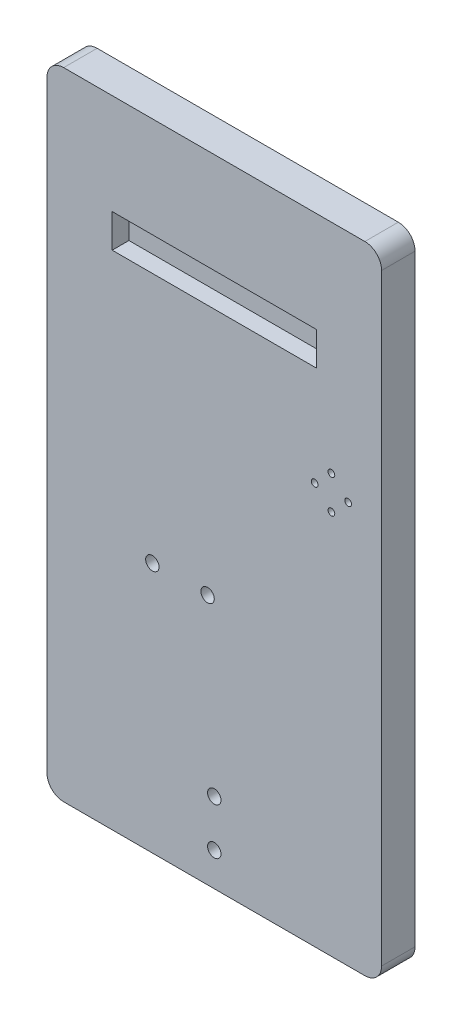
SolidWorks part; units mm, degrees
ref_plane "Face" through (0, 0, 0) normal (0, 0, 1) x (1, 0, 0)
ref_plane "Dessus" through (0, 0, 0) normal (0, 1, 0) x (1, 0, 0)
ref_plane "Droite" through (0, 0, 0) normal (1, 0, 0) x (0, 0, -1)
sketch "Esquisse1" plane through (0, 0, 0) normal (0, 0, 1) x (1, 0, 0)
  line L1 (-100, 190) -> (0, 190)
  line L2 (-100, 190) -> (-100, 0)
  line L3 (-100, 0) -> (0, 0)
  line L4 (0, 190) -> (0, 0)
  dimension "D1" = 100
  dimension "D2" = 190
extrude "Extrusion1" add sketch "Esquisse1" along normal blind 10
fillet "Congé1" radius 5 4 edges at (-100, 190, 5) (0, 190, 5) (0, 0, 5) (-100, 0, 5)
sketch "Esquisse13" plane through (0, 0, 10) normal (0, 0, 1) x (1, 0, 0)
  line L1 (-80.5, 160) -> (-19.5, 160)
  line L2 (-80.5, 160) -> (-80.5, 150)
  line L3 (-80.5, 150) -> (-19.5, 150)
  line L4 (-19.5, 160) -> (-19.5, 150)
  line L6 (-5, 190) -> (-95, 190) construction
  line L7 (-100, 185) -> (-100, 5) construction
  line L8 (0, 5) -> (0, 185) construction
  dimension "D1" = 30
  dimension "D2" = 10
  dimension "D3" = 19.5
  dimension "D4" = 19.5
extrude "Enlèv. mat.-Extru.8" cut sketch "Esquisse13" against normal blind 5
sketch "Esquisse14" plane through (0, 0, 10) normal (0, 0, 1) x (1, 0, 0)
  line L0 (-68.5, 10) -> (-68.5, 93.2446) construction
  line L1 (-95, 0) -> (-5, 0) construction
  line L3 (-100, 185) -> (-100, 5) construction
  circle A0 centre (-68.5, 75) radius 2
  circle A1 centre (-52, 75) radius 2
  dimension "D1" = 4
  dimension "D2" = 4
  dimension "D3" = 75
  dimension "D4" = 16.5
  dimension "D5" = 31.5
extrude "Enlèv. mat.-Extru.9" cut sketch "Esquisse14" against normal blind 10
sketch "Esquisse15" plane through (0, 0, 10) normal (0, 0, 1) x (1, 0, 0)
  line L0 (-5, 190) -> (-95, 190) construction
  line L1 (0, 5) -> (0, 185) construction
  line L2 (-20, 120) -> (-10, 120) construction
  line L3 (-15, 120) -> (-15, 125) construction
  line L4 (-15, 120) -> (-15, 115) construction
  circle A0 centre (-10, 120) radius 1.005
  circle A1 centre (-20, 120) radius 1.005
  circle A2 centre (-15, 125) radius 1.005
  circle A3 centre (-15, 115) radius 1.005
  dimension "D1" = 70
  dimension "D2" = 70
  dimension "D3" = 2.01
  dimension "D4" = 2.01
  dimension "D5" = 10
  dimension "D6" = 10
  dimension "D9" = 2.01
  dimension "D10" = 2.01
  dimension "D7" = 5
  dimension "D8" = 5
extrude "Enlèv. mat.-Extru.10" cut sketch "Esquisse15" against normal blind 10
sketch "Esquisse16" plane through (0, 0, 10) normal (0, 0, 1) x (1, 0, 0)
  line L0 (-50, 0) -> (-50, 67.5588) construction
  line L1 (-95, 0) -> (-5, 0) construction
  circle A0 centre (-50, 10) radius 2
  circle A1 centre (-50, 23.9) radius 2
  dimension "D1" = 4
  dimension "D2" = 4
  dimension "D3" = 13.9
  dimension "D4" = 10
extrude "Enlèv. mat.-Extru.11" cut sketch "Esquisse16" against normal blind 10
